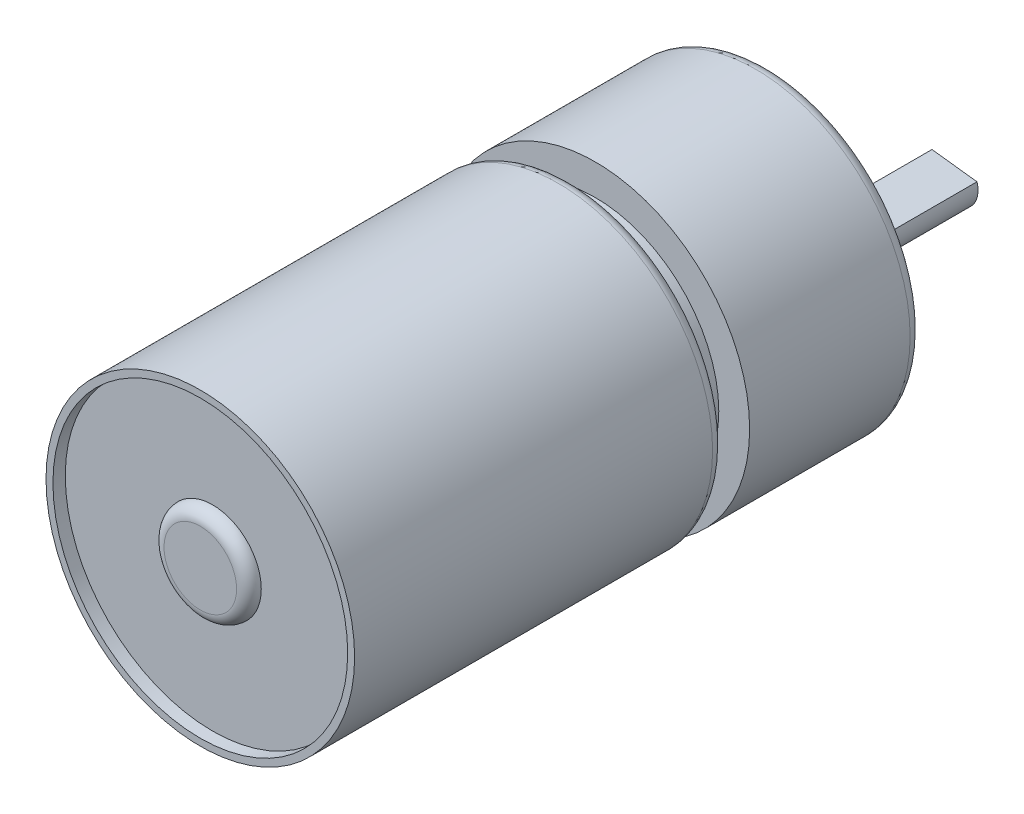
SolidWorks part; units mm, degrees
ref_plane "Front Plane" through (0, 0, 0) normal (0, 0, 1) x (1, 0, 0)
ref_plane "Top Plane" through (0, 0, 0) normal (0, 1, 0) x (1, 0, 0)
ref_plane "Right Plane" through (0, 0, 0) normal (1, 0, 0) x (0, 0, -1)
sketch "Sketch1" plane through (0, 0, 0) normal (0, 0, 1) x (1, 0, 0)
  circle A0 centre (0, 0) radius 12.5
  dimension "D1" = 25
extrude "Boss-Extrude1" add sketch "Sketch1" along normal blind 14
sketch "Sketch2" plane through (0, 0, 14) normal (0, 0, 1) x (1, 0, 0)
  circle A0 centre (0, 0) radius 10
  dimension "D1" = 20
extrude "Boss-Extrude2" add sketch "Sketch2" along normal blind 2
sketch "Sketch3" plane through (0, 0, 16) normal (0, 0, 1) x (1, 0, 0)
  circle A0 centre (0, 0) radius 12.5
  dimension "D1" = 25
extrude "Boss-Extrude3" add sketch "Sketch3" along normal blind 30
sketch "Sketch4" plane through (0, 0, 46) normal (0, 0, 1) x (1, 0, 0)
  circle A0 centre (0, 0) radius 11.9388
extrude "Cut-Extrude1" cut sketch "Sketch4" against normal blind 1
sketch "Sketch5" plane through (0, 0, 45) normal (0, 0, 1) x (1, 0, 0)
  circle A0 centre (0, 0) radius 3.9389
extrude "Boss-Extrude4" add sketch "Sketch5" along normal blind 1
fillet "Fillet1" radius 1 1 edges at (3.9389, 0, 46)
fillet "Fillet2" radius 1 1 edges at (12.5, 0, 0)
fillet "Fillet3" radius 1 2 edges at (12.5, 0, 16) (10, 0, 16)
sketch "Sketch6" plane through (0, 0, 0) normal (0, 0, -1) x (-1, 0, 0)
  circle A0 centre (-9.5, 0) radius 1
  circle A1 centre (9.5, 0) radius 1
  dimension "D3" = 2
  dimension "D4" = 2
  dimension "D1" = 9.5
  dimension "D2" = 9.5
extrude "Cut-Extrude2" cut sketch "Sketch6" against normal blind 5
sketch "Sketch7" plane through (0, 0, 0) normal (0, 0, -1) x (-1, 0, 0)
  line L0 (0, 0) -> (0, -3) construction
  circle A0 centre (0, -3) radius 4.25
  dimension "D1" = 8.5
  dimension "D2" = 3
extrude "Boss-Extrude5" add sketch "Sketch7" along normal blind 3
fillet "Fillet4" radius 0.5 1 edges at (-4.25, -3, -3)
sketch "Sketch8" plane through (0, 0, -3) normal (0, 0, -1) x (-1, 0, 0)
  circle A0 centre (0, -3) radius 2
extrude "Boss-Extrude6" add sketch "Sketch8" along normal blind 12
sketch "Sketch9" plane through (0, 0, -15) normal (0, 0, -1) x (-1, 0, 0)
  line L0 (-1.9191, -2.4368) -> (1.732, -1.9998)
  circle A0 centre (0, -3) radius 2 construction
extrude "Cut-Extrude3" cut sketch "Sketch9" against normal blind 9 and the other way through all
